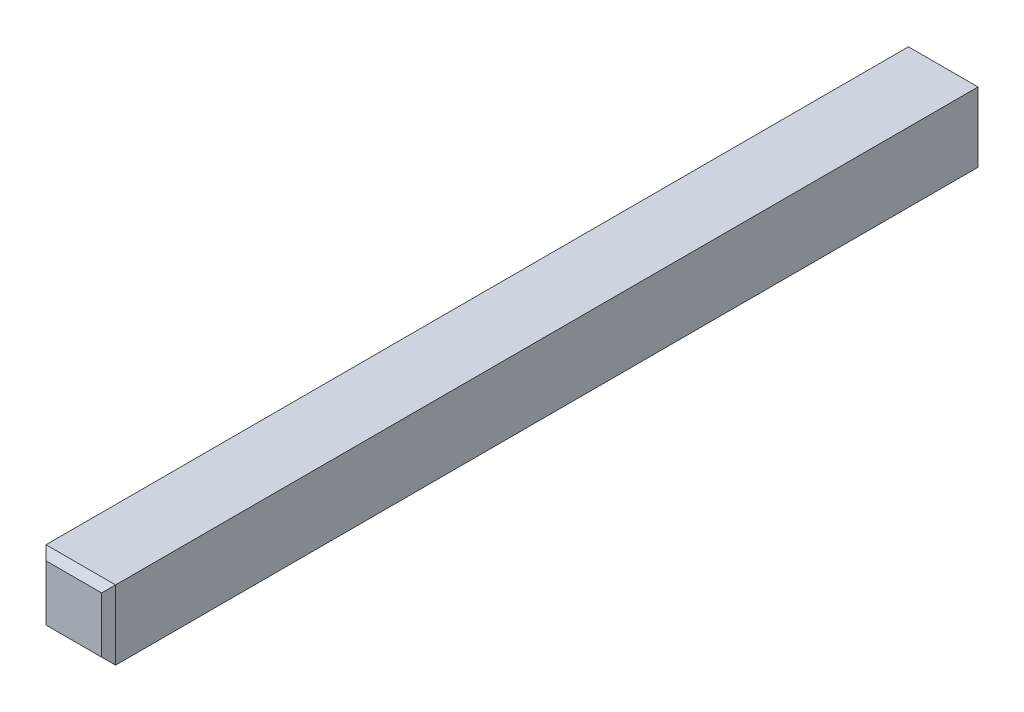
SolidWorks part; units mm, degrees
ref_plane "Front Plane" through (0, 0, 0) normal (0, 0, 1) x (1, 0, 0)
ref_plane "Top Plane" through (0, 0, 0) normal (0, 1, 0) x (1, 0, 0)
ref_plane "Right Plane" through (0, 0, 0) normal (1, 0, 0) x (0, 0, -1)
sketch "Sketch1" plane through (0, 0, 0) normal (0, 0, 1) x (1, 0, 0)
  line L1 (-2, -2) -> (2, -2)
  line L2 (-2, -2) -> (-2, 2)
  line L3 (-2, 2) -> (2, 2)
  line L4 (2, -2) -> (2, 2)
  line L5 (-2, -2) -> (2, 2) construction
  line L6 (-2, 2) -> (2, -2) construction
  point P0 (0, 0)
  dimension "D1" = 4
  dimension "D2" = 4
extrude "Boss-Extrude1" add sketch "Sketch1" along normal mid plane 50
chamfer "Chamfer1" distance 0.4 angle 45 4 edges at (0, -2, 25) (-2, 0, 25) (0, 2, 25) (2, 0, 25)
